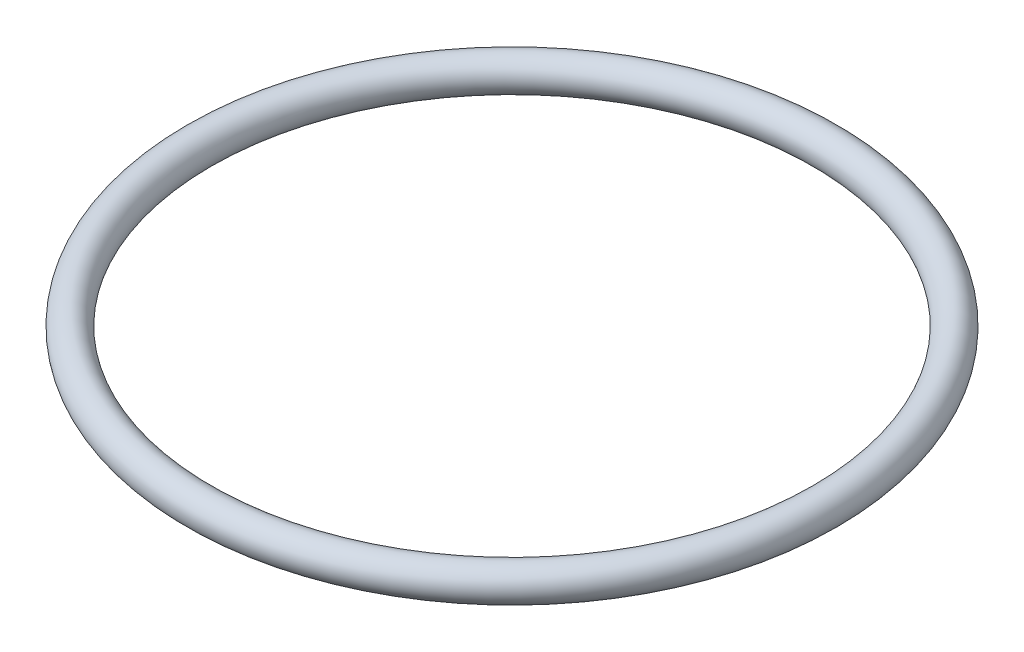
SolidWorks part; units mm, degrees
ref_plane "Face" through (0, 0, 0) normal (0, 0, 1) x (1, 0, 0)
ref_plane "Dessus" through (0, 0, 0) normal (0, 1, 0) x (1, 0, 0)
ref_plane "Droite" through (0, 0, 0) normal (1, 0, 0) x (0, 0, -1)
sketch "Esquisse1" plane through (0, 0, 0) normal (0, 0, 1) x (1, 0, 0)
  line L0 (0, 10) -> (0, 50.1879) construction
  circle A0 centre (18.5, 30.3) radius 1
  dimension "D1" = 2
  dimension "D2" = 35
revolve "Révolution1" add sketch "Esquisse1" angle 360 about L0
